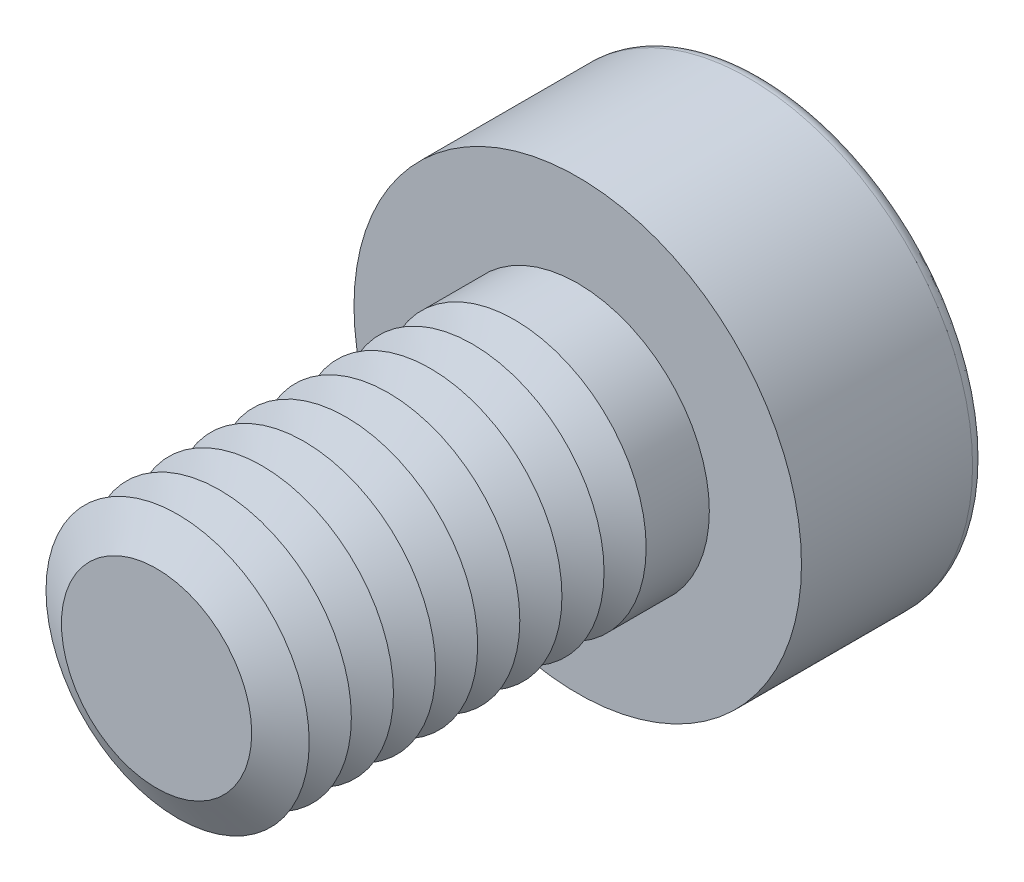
SolidWorks part; units mm, degrees
ref_plane "Front Plane" through (0, 0, 0) normal (0, 0, 1) x (1, 0, 0)
ref_plane "Top Plane" through (0, 0, 0) normal (0, 1, 0) x (1, 0, 0)
ref_plane "Right Plane" through (0, 0, 0) normal (1, 0, 0) x (0, 0, -1)
sketch "Sketch1" plane through (0, 0, 0) normal (0, 0, 1) x (1, 0, 0)
  circle A0 centre (0, 0) radius 2.5
  dimension "D1" = 5
extrude "Boss-Extrude1" add sketch "Sketch1" along normal blind 8
sketch "Sketch2" plane through (0, 0, 0) normal (0, 0, -1) x (-1, 0, 0)
  circle A0 centre (0, 0) radius 4.25
  dimension "D1" = 8.5
extrude "Boss-Extrude2" add sketch "Sketch2" along normal blind 3.5
sketch "Sketch3" plane through (0, 0, -3.5) normal (0, 0, -1) x (-1, 0, 0)
  line L1 (-0.866, 1.5) -> (-1.7321, 0)
  line L2 (-1.7321, 0) -> (-0.866, -1.5)
  line L3 (-0.866, -1.5) -> (0.866, -1.5)
  line L4 (0.866, -1.5) -> (1.7321, 0)
  line L5 (1.7321, 0) -> (0.866, 1.5)
  line L6 (0.866, 1.5) -> (-0.866, 1.5)
  circle A0 centre (0, 0) radius 1.5 construction
  dimension "D1" = 3
extrude "Cut-Extrude1" cut sketch "Sketch3" against normal blind 2.25
fillet "Fillet1" radius 0.25 1 edges at (-4.25, 0, -3.5)
sketch "Sketch4" plane through (0, 0, -1.25) normal (0, 0, -1) x (-1, 0, 0)
  line L0 (0.866, -1.5) -> (1.7321, 0) construction
  circle A0 centre (0, 0) radius 1.5
extrude "Cut-Extrude2" cut sketch "Sketch4" against normal through all draft 60
sketch "Sketch5" plane through (0, 0, -3.5) normal (0, 0, -1) x (-1, 0, 0)
  circle A0 centre (0, 0) radius 1.7321
extrude "Cut-Extrude3" cut sketch "Sketch5" against normal through all draft 75
sketch "Sketch7" plane through (0, 0, 0) normal (1, 0, 0) x (0, 0, -1)
  line L25 (-8, 1.8072) -> (-7.6, 2.5)
  line L26 (-8, 2.5) -> (-8, -2.5) construction
  line L27 (-7.6, 2.5) -> (-8.4, 2.5)
  line L28 (-8.4, 2.5) -> (-8, 1.8072)
  line L29 (0, 2.5) -> (-8, 2.5) construction
  dimension "D1" = 0.8
revolve "Cut-Revolve1" cut sketch "Sketch7" angle 360 about axis through (0, 0, 8) along (0, 0, -1)
pattern_linear "LPattern1" count 9 spacing 0.8 along (0, 0, -1) of "Cut-Revolve1"
